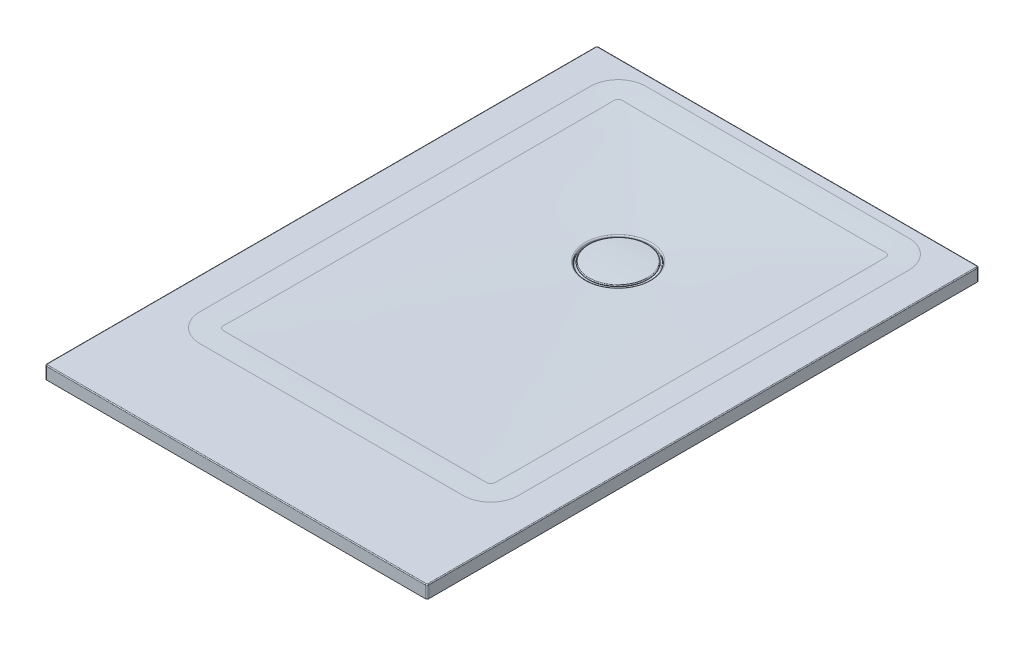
SolidWorks part; units mm, degrees
ref_plane "Płaszczyzna przednia" through (0, 0, 0) normal (0, 0, 1) x (1, 0, 0)
ref_plane "Płaszczyzna górna" through (0, 0, 0) normal (0, 1, 0) x (1, 0, 0)
ref_plane "Płaszczyzna prawa" through (0, 0, 0) normal (1, 0, 0) x (0, 0, -1)
sketch "Szkic2" plane through (0, 0, 0) normal (0, 1, 0) x (1, 0, 0)
  line L0 (0, 650) -> (0, 250) construction
  line L1 (-450, -650) -> (450, -650)
  line L2 (-450, -650) -> (-450, 650)
  line L3 (-450, 650) -> (450, 650)
  line L4 (450, -650) -> (450, 650)
  line L5 (-450, -650) -> (450, 650) construction
  line L6 (-450, 650) -> (450, -650) construction
  line L7 (-360, 610) -> (360, 610)
  line L8 (-360, 610) -> (-360, -410)
  line L9 (-360, -410) -> (360, -410)
  line L10 (360, 610) -> (360, -410)
  line L11 (-400, 650) -> (-400, -450) construction
  line L12 (-400, -450) -> (400, -450) construction
  line L13 (400, -450) -> (400, 650) construction
  circle A0 centre (0, 250) radius 75
  point P0 (0, 0)
  point P11 (0, 610)
  point P16 (0, -450)
  dimension "D9" = 150
  dimension "D1" = 900
  dimension "D2" = 1300
  dimension "D3" = 40
  dimension "D4" = 90
  dimension "D5" = 40
  dimension "D6" = 50
  dimension "D7" = 1100
  dimension "D8" = 400
  dimension "D10" = 800
sketch "Szkic3" plane through (0, 0, 0) normal (0, 1, 0) x (1, 0, 0)
  line L0 (-450, -650) -> (-450, 650) construction
  line L1 (-450, -650) -> (450, -650) construction
  line L2 (450, -650) -> (450, 650) construction
  line L3 (-450, 650) -> (450, 650) construction
  line L4 (-360, 610) -> (-360, -410) construction
  line L5 (-360, 610) -> (360, 610) construction
  line L6 (360, 610) -> (360, -410) construction
  line L7 (-360, -410) -> (360, -410) construction
  line L8 (-450, -650) -> (-450, 650)
  line L9 (-450, -650) -> (450, -650)
  line L10 (450, -650) -> (450, 650)
  line L11 (-450, 650) -> (450, 650)
  line L12 (-360, 560) -> (-360, -360)
  line L13 (-310, 610) -> (310, 610)
  line L14 (360, 560) -> (360, -360)
  line L15 (-310, -410) -> (310, -410)
  arc A0 (360, 560) -> (310, 610) centre (310, 560) ccw
  arc A1 (-310, 610) -> (-360, 560) centre (-310, 560) ccw
  arc A2 (310, -410) -> (360, -360) centre (310, -360) ccw
  arc A3 (-310, -410) -> (-360, -360) centre (-310, -360) cw
  dimension "D1" = 50
surface "Powierzchnia-Płaszczyzna1" sketch "Szkic3"
sketch "Szkic4" plane through (0, 0, 0) normal (0, 1, 0) x (1, 0, 0)
  line L0 (-360, 610) -> (-360, -410) construction
  line L1 (-360, -410) -> (360, -410) construction
  line L2 (360, 610) -> (360, -410) construction
  line L3 (-360, 610) -> (360, 610) construction
  line L4 (-360, 610) -> (-360, -410)
  line L5 (-360, -410) -> (360, -410)
  line L6 (360, 610) -> (360, -410)
  line L7 (-360, 610) -> (360, 610)
ref_plane "korek" through (0, -15, 0) normal (0, 1, 0) x (-1, 0, 0)
sketch "Szkic5" plane through (0, -15, 0) normal (0, 1, 0) x (-1, 0, 0)
  circle A0 centre (0, -250) radius 75 construction
  circle A1 centre (0, -250) radius 75
surface "Powierzchnia-Wyciągnięcie po profilach2"
surface "Powierzchnia-Połącz1"
sketch "Szkic7" plane through (0, 0, 0) normal (0, 1, 0) x (1, 0, 0)
  line L27 (310, 570) -> (-310, 570)
  line L28 (-320, 560) -> (-320, -360)
  line L29 (-310, -370) -> (310, -370)
  line L30 (320, -360) -> (320, 560)
  line L31 (310, 570) -> (-310, 570)
  line L32 (-320, 560) -> (-320, -360)
  line L33 (-310, -370) -> (310, -370)
  line L34 (320, -360) -> (320, 560)
  line L35 (310, 625) -> (-310, 625)
  line L36 (-375, 560) -> (-375, -360)
  line L37 (-310, -425) -> (310, -425)
  line L38 (375, -360) -> (375, 560)
  line L39 (310, 625) -> (-310, 625)
  line L40 (-375, 560) -> (-375, -360)
  line L41 (-310, -425) -> (310, -425)
  line L42 (375, -360) -> (375, 560)
  arc A0 (320, -360) -> (310, -370) centre (310, -360) cw
  arc A1 (-320, -360) -> (-310, -370) centre (-310, -360) ccw
  arc A2 (320, 560) -> (310, 570) centre (310, 560) ccw
  arc A3 (-320, 560) -> (-310, 570) centre (-310, 560) cw
  spline S23 degree 3 poles (-635.8034, 265.9977) (49.8537, 427.1838) (328.3761, 519.0178) (319.7449, 562.2676) (319.6658, 562.5843) (319.4758, 563.2122) (319.3643, 563.5244) (318.9879, 564.432) (318.6813, 565.0062) (318.1376, 565.8211) (317.9417, 566.0858) (317.5239, 566.5954) (316.8643, 567.3228) (316.1099, 567.9437) (315.2909, 568.492) (315.0071, 568.6624) (314.4302, 568.9711) (314.1357, 569.1106) (313.5346, 569.3602) (313.2279, 569.4703) (312.6026, 569.661) (312.2823, 569.7413) (211.2754, 590.0286) (-66.776, -984.2596) (112.2182, 1550.2349) knots -8.278382 -8.278382 -8.278382 -8.278382 0.125 0.125 0.1875 0.1875 0.25 0.25 0.375 0.375 0.4375 0.4375 0.5 0.625 0.625 0.6875 0.6875 0.75 0.75 0.8125 0.8125 0.875 0.875 20.361011 20.361011 20.361011 20.361011 only from (320, 560) to (310, 570)
  spline S24 degree 3 poles (-21.1182, -387.3633) (-184.5521, 322.179) (-270.7344, 578.0385) (-312.2678, 569.7446) (-312.5846, 569.6659) (-313.2125, 569.4756) (-313.5247, 569.364) (-314.4326, 568.9879) (-315.0067, 568.6809) (-315.8218, 568.1373) (-316.0865, 567.9412) (-316.5961, 567.5234) (-316.8386, 567.3035) (-317.5302, 566.612) (-317.9442, 566.109) (-318.4926, 565.29) (-318.6629, 565.0062) (-318.9715, 564.4293) (-319.1109, 564.1347) (-319.3607, 563.5337) (-319.4707, 563.227) (-319.6612, 562.6016) (-319.7418, 562.2813) (-336.719, 477.697) (766.5258, 268.829) (-1309.212, 413.5918) knots -7.94165 -7.94165 -7.94165 -7.94165 0.125 0.125 0.1875 0.1875 0.25 0.25 0.375 0.375 0.4375 0.4375 0.5 0.5 0.625 0.625 0.6875 0.6875 0.75 0.75 0.8125 0.8125 0.875 0.875 17.189814 17.189814 17.189814 17.189814 only from (-310, 570) to (-320, 560)
  spline S25 degree 3 poles (635.8032, -65.9977) (-49.8537, -227.1838) (-328.3761, -319.0178) (-319.7449, -362.2676) (-319.6658, -362.5843) (-319.4758, -363.2122) (-319.3643, -363.5244) (-318.9879, -364.432) (-318.6813, -365.0062) (-318.1376, -365.8211) (-317.9417, -366.0858) (-317.5239, -366.5954) (-316.8643, -367.3228) (-316.1099, -367.9437) (-315.2909, -368.492) (-315.0071, -368.6624) (-314.4302, -368.9711) (-314.1357, -369.1106) (-313.5346, -369.3602) (-313.2279, -369.4703) (-312.6026, -369.661) (-312.2823, -369.7413) (-211.2754, -390.0286) (66.776, 1184.2596) (-112.2183, -1350.2348) knots -8.278382 -8.278382 -8.278382 -8.278382 0.125 0.125 0.1875 0.1875 0.25 0.25 0.375 0.375 0.4375 0.4375 0.5 0.625 0.625 0.6875 0.6875 0.75 0.75 0.8125 0.8125 0.875 0.875 20.361011 20.361011 20.361011 20.361011 only from (-320, -360) to (-310, -370)
  spline S26 degree 3 poles (21.1182, 587.3632) (184.5521, -122.179) (270.7344, -378.0385) (312.2678, -369.7446) (312.5846, -369.6659) (313.2125, -369.4756) (313.5247, -369.364) (314.4326, -368.9879) (315.0067, -368.6809) (315.8218, -368.1373) (316.0865, -367.9412) (316.5961, -367.5234) (316.8386, -367.3035) (317.5302, -366.612) (317.9442, -366.109) (318.4926, -365.29) (318.6629, -365.0062) (318.9715, -364.4293) (319.1109, -364.1347) (319.3607, -363.5337) (319.4707, -363.227) (319.6612, -362.6016) (319.7418, -362.2813) (336.719, -277.697) (-766.5258, -68.829) (1309.212, -213.5918) knots -7.94165 -7.94165 -7.94165 -7.94165 0.125 0.125 0.1875 0.1875 0.25 0.25 0.375 0.375 0.4375 0.4375 0.5 0.5 0.625 0.625 0.6875 0.6875 0.75 0.75 0.8125 0.8125 0.875 0.875 17.189814 17.189814 17.189814 17.189814 only from (310, -370) to (320, -360)
  spline S31 degree 3 poles (-2457.959, -386.1275) (-141.965, 165.0876) (389.908, 412.3404) (374.4771, 568.4945) (374.1674, 570.5876) (373.3423, 574.7389) (372.8283, 576.7972) (371.9015, 579.8581) (371.5658, 580.8757) (370.8441, 582.8943) (370.4598, 583.8906) (368.4226, 588.8081) (366.4285, 592.54) (363.4836, 596.9543) (362.8719, 597.8246) (361.6021, 599.5393) (360.9423, 600.386) (358.9054, 602.8702) (357.4763, 604.4465) (352.9828, 608.9434) (349.7137, 611.6341) (345.2776, 614.6043) (344.3701, 615.18) (342.5355, 616.2813) (341.6081, 616.8072) (338.796, 618.3122) (336.8814, 619.2188) (332.974, 620.8414) (330.9812, 621.5573) (327.9324, 622.4865) (326.9062, 622.772) (324.8335, 623.2937) (323.7851, 623.5303) (320.6362, 624.1599) (318.5252, 624.4737) (161.4807, 639.9995) (-54.545, 105.1318) (-473.478, -2256.7287) knots -4.499608 -4.499608 -4.499608 -4.499608 0.0625 0.0625 0.125 0.125 0.1875 0.1875 0.21875 0.21875 0.25 0.25 0.375 0.375 0.40625 0.40625 0.4375 0.4375 0.5 0.5 0.625 0.625 0.65625 0.65625 0.6875 0.6875 0.75 0.75 0.8125 0.8125 0.84375 0.84375 0.875 0.875 0.9375 0.9375 5.499189 5.499189 5.499189 5.499189 only from (375, 560) to (310, 625)
  spline S32 degree 3 poles (599.8814, -2221.0806) (44.2613, 196.4506) (-174.9066, 638.6321) (-318.4947, 624.4774) (-320.5878, 624.1671) (-324.7391, 623.3419) (-326.7976, 622.8284) (-329.8586, 621.9013) (-330.8761, 621.5656) (-332.8948, 620.8439) (-333.8911, 620.4595) (-338.8087, 618.4225) (-342.5405, 616.4281) (-346.955, 613.4833) (-347.8252, 612.8715) (-349.54, 611.6016) (-350.3867, 610.9417) (-352.8709, 608.9048) (-354.4472, 607.4757) (-358.9438, 602.982) (-361.6345, 599.7128) (-364.6049, 595.2766) (-365.1807, 594.3692) (-366.2818, 592.5346) (-366.8077, 591.6072) (-368.3127, 588.795) (-369.2191, 586.8805) (-370.8419, 582.9732) (-371.5577, 580.9803) (-372.4867, 577.9314) (-372.7721, 576.9051) (-373.2938, 574.8324) (-373.5308, 573.7841) (-374.1603, 570.6355) (-374.4735, 568.5245) (-392.0414, 391.2493) (302.1023, 137.0575) (2488.3782, -282.8915) knots -4.127206 -4.127206 -4.127206 -4.127206 0.0625 0.0625 0.125 0.125 0.1875 0.1875 0.21875 0.21875 0.25 0.25 0.375 0.375 0.40625 0.40625 0.4375 0.4375 0.5 0.5 0.625 0.625 0.65625 0.65625 0.6875 0.6875 0.75 0.75 0.8125 0.8125 0.84375 0.84375 0.875 0.875 0.9375 0.9375 6.095408 6.095408 6.095408 6.095408 only from (-310, 625) to (-375, 560)
  spline S33 degree 3 poles (2457.9592, 586.1276) (141.965, 34.9124) (-389.908, -212.3404) (-374.4771, -368.4945) (-374.1674, -370.5876) (-373.3423, -374.7389) (-372.8283, -376.7972) (-371.9015, -379.8581) (-371.5658, -380.8757) (-370.8441, -382.8943) (-370.4598, -383.8906) (-368.4226, -388.8081) (-366.4285, -392.54) (-363.4836, -396.9543) (-362.8719, -397.8246) (-361.6021, -399.5393) (-360.9423, -400.386) (-358.9054, -402.8702) (-357.4763, -404.4465) (-352.9828, -408.9434) (-349.7137, -411.6341) (-345.2776, -414.6043) (-344.3701, -415.18) (-342.5355, -416.2813) (-341.6081, -416.8072) (-338.796, -418.3122) (-336.8814, -419.2188) (-332.974, -420.8414) (-330.9812, -421.5573) (-327.9324, -422.4865) (-326.9062, -422.772) (-324.8335, -423.2937) (-323.7851, -423.5303) (-320.6362, -424.1599) (-318.5252, -424.4737) (-161.4807, -439.9995) (54.545, 94.8682) (473.478, 2456.7287) knots -4.499608 -4.499608 -4.499608 -4.499608 0.0625 0.0625 0.125 0.125 0.1875 0.1875 0.21875 0.21875 0.25 0.25 0.375 0.375 0.40625 0.40625 0.4375 0.4375 0.5 0.5 0.625 0.625 0.65625 0.65625 0.6875 0.6875 0.75 0.75 0.8125 0.8125 0.84375 0.84375 0.875 0.875 0.9375 0.9375 5.499189 5.499189 5.499189 5.499189 only from (-375, -360) to (-310, -425)
  spline S34 degree 3 poles (-599.8814, 2421.0806) (-44.2613, 3.5494) (174.9066, -438.6321) (318.4947, -424.4774) (320.5878, -424.1671) (324.7391, -423.3419) (326.7976, -422.8284) (329.8586, -421.9013) (330.8761, -421.5656) (332.8948, -420.8439) (333.8911, -420.4595) (338.8087, -418.4225) (342.5405, -416.4281) (346.955, -413.4833) (347.8252, -412.8715) (349.54, -411.6016) (350.3867, -410.9417) (352.8709, -408.9048) (354.4472, -407.4757) (358.9438, -402.982) (361.6345, -399.7128) (364.6049, -395.2766) (365.1807, -394.3692) (366.2818, -392.5346) (366.8077, -391.6072) (368.3127, -388.795) (369.2191, -386.8805) (370.8419, -382.9732) (371.5577, -380.9803) (372.4867, -377.9314) (372.7721, -376.9051) (373.2938, -374.8324) (373.5308, -373.7841) (374.1603, -370.6355) (374.4735, -368.5245) (392.0414, -191.2493) (-302.1023, 62.9425) (-2488.3782, 482.8915) knots -4.127206 -4.127206 -4.127206 -4.127206 0.0625 0.0625 0.125 0.125 0.1875 0.1875 0.21875 0.21875 0.25 0.25 0.375 0.375 0.40625 0.40625 0.4375 0.4375 0.5 0.5 0.625 0.625 0.65625 0.65625 0.6875 0.6875 0.75 0.75 0.8125 0.8125 0.84375 0.84375 0.875 0.875 0.9375 0.9375 6.095408 6.095408 6.095408 6.095408 only from (310, -425) to (375, -360)
  spline S35 degree 3 poles (375, 560) (375, 562.1459) (374.8941, 564.2738) (374.4771, 568.4945) (374.1674, 570.5876) (373.3423, 574.7389) (372.8283, 576.7972) (371.9015, 579.8581) (371.5658, 580.8757) (370.8441, 582.8943) (370.4598, 583.8906) (368.4226, 588.8081) (366.4285, 592.54) (363.4836, 596.9543) (362.8719, 597.8246) (361.6021, 599.5393) (360.9423, 600.386) (358.9054, 602.8702) (357.4763, 604.4465) (352.9828, 608.9434) (349.7137, 611.6341) (345.2776, 614.6043) (344.3701, 615.18) (342.5355, 616.2813) (341.6081, 616.8072) (338.796, 618.3122) (336.8814, 619.2188) (332.974, 620.8414) (330.9812, 621.5573) (327.9324, 622.4865) (326.9062, 622.772) (324.8335, 623.2937) (323.7851, 623.5303) (320.6362, 624.1599) (318.5252, 624.4737) (314.28, 624.8934) (312.1459, 625) (310, 625) knots 0 0 0 0 0.0625 0.0625 0.125 0.125 0.1875 0.1875 0.21875 0.21875 0.25 0.25 0.375 0.375 0.40625 0.40625 0.4375 0.4375 0.5 0.5 0.625 0.625 0.65625 0.65625 0.6875 0.6875 0.75 0.75 0.8125 0.8125 0.84375 0.84375 0.875 0.875 0.9375 0.9375 1 1 1 1
  spline S36 degree 3 poles (-310, 625) (-312.1459, 625) (-314.2737, 624.8935) (-318.4947, 624.4774) (-320.5878, 624.1671) (-324.7391, 623.3419) (-326.7976, 622.8284) (-329.8586, 621.9013) (-330.8761, 621.5656) (-332.8948, 620.8439) (-333.8911, 620.4595) (-338.8087, 618.4225) (-342.5405, 616.4281) (-346.955, 613.4833) (-347.8252, 612.8715) (-349.54, 611.6016) (-350.3867, 610.9417) (-352.8709, 608.9048) (-354.4472, 607.4757) (-358.9438, 602.982) (-361.6345, 599.7128) (-364.6049, 595.2766) (-365.1807, 594.3692) (-366.2818, 592.5346) (-366.8077, 591.6072) (-368.3127, 588.795) (-369.2191, 586.8805) (-370.8419, 582.9732) (-371.5577, 580.9803) (-372.4867, 577.9314) (-372.7721, 576.9051) (-373.2938, 574.8324) (-373.5308, 573.7841) (-374.1603, 570.6355) (-374.4735, 568.5245) (-374.8941, 564.2797) (-375, 562.1457) (-375, 560) knots 0 0 0 0 0.0625 0.0625 0.125 0.125 0.1875 0.1875 0.21875 0.21875 0.25 0.25 0.375 0.375 0.40625 0.40625 0.4375 0.4375 0.5 0.5 0.625 0.625 0.65625 0.65625 0.6875 0.6875 0.75 0.75 0.8125 0.8125 0.84375 0.84375 0.875 0.875 0.9375 0.9375 1 1 1 1
  spline S37 degree 3 poles (-375, -360) (-375, -362.1459) (-374.8941, -364.2738) (-374.4771, -368.4945) (-374.1674, -370.5876) (-373.3423, -374.7389) (-372.8283, -376.7972) (-371.9015, -379.8581) (-371.5658, -380.8757) (-370.8441, -382.8943) (-370.4598, -383.8906) (-368.4226, -388.8081) (-366.4285, -392.54) (-363.4836, -396.9543) (-362.8719, -397.8246) (-361.6021, -399.5393) (-360.9423, -400.386) (-358.9054, -402.8702) (-357.4763, -404.4465) (-352.9828, -408.9434) (-349.7137, -411.6341) (-345.2776, -414.6043) (-344.3701, -415.18) (-342.5355, -416.2813) (-341.6081, -416.8072) (-338.796, -418.3122) (-336.8814, -419.2188) (-332.974, -420.8414) (-330.9812, -421.5573) (-327.9324, -422.4865) (-326.9062, -422.772) (-324.8335, -423.2937) (-323.7851, -423.5303) (-320.6362, -424.1599) (-318.5252, -424.4737) (-314.28, -424.8934) (-312.1459, -425) (-310, -425) knots 0 0 0 0 0.0625 0.0625 0.125 0.125 0.1875 0.1875 0.21875 0.21875 0.25 0.25 0.375 0.375 0.40625 0.40625 0.4375 0.4375 0.5 0.5 0.625 0.625 0.65625 0.65625 0.6875 0.6875 0.75 0.75 0.8125 0.8125 0.84375 0.84375 0.875 0.875 0.9375 0.9375 1 1 1 1
  spline S38 degree 3 poles (310, -425) (312.1459, -425) (314.2737, -424.8935) (318.4947, -424.4774) (320.5878, -424.1671) (324.7391, -423.3419) (326.7976, -422.8284) (329.8586, -421.9013) (330.8761, -421.5656) (332.8948, -420.8439) (333.8911, -420.4595) (338.8087, -418.4225) (342.5405, -416.4281) (346.955, -413.4833) (347.8252, -412.8715) (349.54, -411.6016) (350.3867, -410.9417) (352.8709, -408.9048) (354.4472, -407.4757) (358.9438, -402.982) (361.6345, -399.7128) (364.6049, -395.2766) (365.1807, -394.3692) (366.2818, -392.5346) (366.8077, -391.6072) (368.3127, -388.795) (369.2191, -386.8805) (370.8419, -382.9732) (371.5577, -380.9803) (372.4867, -377.9314) (372.7721, -376.9051) (373.2938, -374.8324) (373.5308, -373.7841) (374.1603, -370.6355) (374.4735, -368.5245) (374.8941, -364.2797) (375, -362.1457) (375, -360) knots 0 0 0 0 0.0625 0.0625 0.125 0.125 0.1875 0.1875 0.21875 0.21875 0.25 0.25 0.375 0.375 0.40625 0.40625 0.4375 0.4375 0.5 0.5 0.625 0.625 0.65625 0.65625 0.6875 0.6875 0.75 0.75 0.8125 0.8125 0.84375 0.84375 0.875 0.875 0.9375 0.9375 1 1 1 1
  dimension "D3" = 10
  dimension "D1" = 40
  dimension "D2" = 15
other "Usuń ścianę1"
other "Granica-Powierzchnia1"
surface "Powierzchnia-Połącz2"
sketch "Szkic9" plane through (0, 0, 0) normal (0, 1, 0) x (1, 0, 0)
  line L0 (-450, -650) -> (450, -650) construction
  line L1 (-450, -650) -> (-450, 650) construction
  line L2 (450, -650) -> (450, 650) construction
  line L3 (-450, 650) -> (450, 650) construction
  line L4 (-450, -650) -> (450, -650)
  line L5 (-450, -650) -> (-450, 650)
  line L6 (450, -650) -> (450, 650)
  line L7 (-450, 650) -> (450, 650)
surface "Powierzchnia-Wyciągnięcie1" sketch "Szkic9" parameters "D1"=30
sketch "Szkic8" plane through (0, 0, 0) normal (1, 0, 0) x (0, 0, -1)
  line L0 (250, 0) -> (250, -30) construction
  line L1 (174.9999, -15) -> (175.2968, -23.5)
  line L4 (175.2968, -23.5) -> (198, -24.0945)
  line L5 (175.2968, -23.5) -> (250, -23.5) construction
  line L6 (198, -24.0945) -> (198, -30) construction
  line L7 (250, -30) -> (175.2968, -30) construction
  line L8 (175.2968, -30) -> (175.2968, -23.5) construction
  line L9 (205, -28) -> (205, -30)
  line L10 (198, -24.0945) -> (205, -28)
  dimension "D1" = 30
  dimension "D2" = 8.5
  dimension "D3" = 2
  dimension "D4" = 1.5
  dimension "D5" = 52
  dimension "D6" = 45
  dimension "D7" = 2
surface "Powierzchnia-Obrót1" sketch "Szkic8" parameters "D1"=360
surface "Powierzchnia-Płaszczyzna2"
surface "Powierzchnia-Połącz3"
fillet "Zaokrąglenie4" radius 4 4 edges at (-450, -15, -650) (450, -15, -650) (-450, -15, 650) (450, -15, 650)
fillet "Zaokrąglenie5" radius 3 3 edges at (0, -24.0945, -302) (0, -23.5, -324.7032)
fillet "Zaokrąglenie6" radius 2 9 edges at (448.8284, 0, 648.8284) (0, 0, 650) (-448.8284, 0, 648.8284) (-450, 0, 0) (-448.8284, 0, -648.8284) (0, 0, -650) (448.8284, 0, -648.8284) (450, 0, 0) (0, -28, -295)
sketch "Szkic11" plane through (0, 0, 0) normal (1, 0, 0) x (0, 0, -1)
  line L0 (250, 0) -> (250, -30) construction
  line L1 (-646, -30) -> (646, -30) construction
  line L2 (250, -17) -> (250, -11.5)
  line L14 (320, -11.5) -> (320, -14.5) construction
  line L16 (320, -17) -> (250, -17)
  line L18 (320, -17) -> (320, -16.3377)
  line L19 (250, -11.5) -> (320, -11.5) construction
  arc A0 (320, -16.3377) -> (318.1666, -14.3446) centre (318, -16.3377) ccw
  arc A6 (318.1666, -14.3446) -> (250, -11.5) centre (250, -829.6667) ccw
  dimension "D2" = 2
  dimension "D8" = 2.5
  dimension "D9" = 17
  dimension "D10" = 5.5
  dimension "D11" = 70
revolve "Obrót1" add sketch "Szkic11" angle 360 about L0
